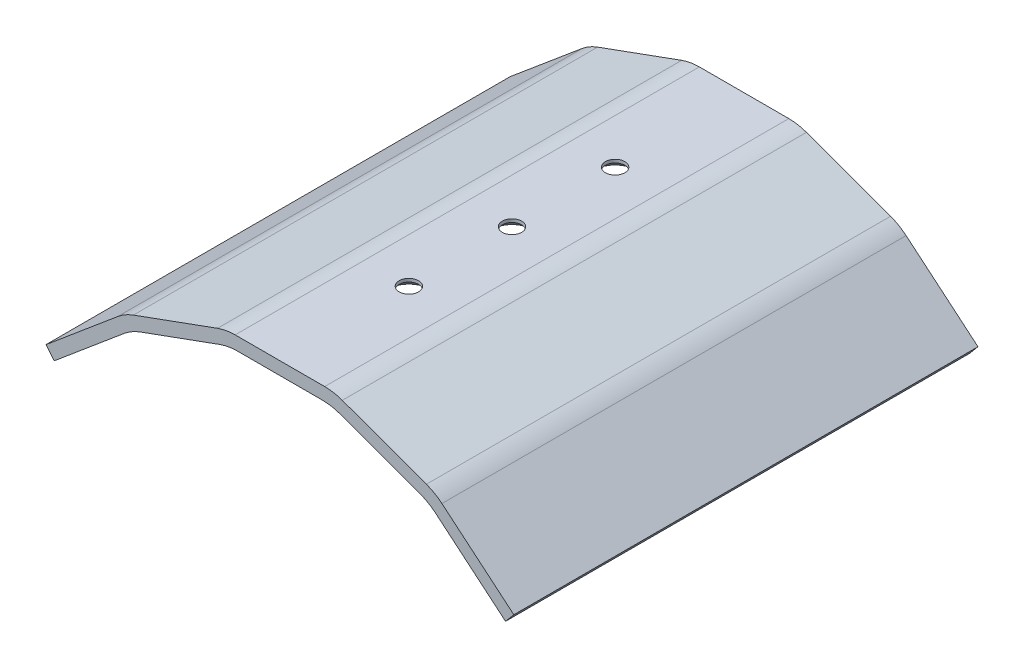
SolidWorks part; units mm, degrees
ref_plane "Front Plane" through (0, 0, 0) normal (0, 0, 1) x (1, 0, 0)
ref_plane "Top Plane" through (0, 0, 0) normal (0, 1, 0) x (1, 0, 0)
ref_plane "Right Plane" through (0, 0, 0) normal (1, 0, 0) x (0, 0, -1)
sketch "Sketch1" plane through (0, 0, 0) normal (0, 0, 1) x (1, 0, 0)
  line L0 (0, 0) -> (0, 14.4748) construction
  line L1 (0, 0) -> (12.7, 0)
  line L2 (12.7, 0) -> (36.5682, -8.6873)
  line L3 (36.5682, -8.6873) -> (55.5625, -24.6254)
  line L4 (55.5625, -24.6254) -> (57.6034, -22.1932)
  line L5 (57.6034, -22.1932) -> (38.1802, -5.8953)
  line L6 (38.1802, -5.8953) -> (13.2598, 3.175)
  line L7 (13.2598, 3.175) -> (-13.2598, 3.175)
  line L8 (-13.2598, 3.175) -> (-38.1802, -5.8953)
  line L9 (-38.1802, -5.8953) -> (-57.6034, -22.1932)
  line L10 (-57.6034, -22.1932) -> (-55.5625, -24.6254)
  line L11 (-55.5625, -24.6254) -> (-36.5682, -8.6873)
  line L12 (-36.5682, -8.6873) -> (-12.7, 0)
  line L13 (-12.7, 0) -> (0, 0)
  dimension "D1" = 3.175
  dimension "D2" = 3.175
  dimension "D3" = 3.175
  dimension "D4" = 111.125
  dimension "D5" = 160
  dimension "D6" = 160
  dimension "D7" = 25.4
  dimension "D8" = 25.4
  dimension "D9" = 25.3551
  dimension "D10" = 26.5197
  dimension "D11" = 26.5197
  dimension "D12" = 26.5197
  dimension "D13" = 25.3551
extrude "Boss-Extrude1" add sketch "Sketch1" along normal blind 114.3
fillet "Fillet1" radius 12.7 8 edges at (-36.5682, -8.6873, 57.15) (-12.7, 0, 57.15) (12.7, 0, 57.15) (36.5682, -8.6873, 57.15) (38.1802, -5.8953, 57.15) (13.2598, 3.175, 57.15) (-13.2598, 3.175, 57.15) (-38.1802, -5.8953, 57.15)
sketch "Sketch2" plane through (0, 0, 0) normal (0, 1, 0) x (1, 0, 0)
  line L0 (-11.0205, -57.15) -> (11.0205, -57.15) construction
  line L1 (-11.0205, 0) -> (-11.0205, -114.3) construction
  line L2 (11.0205, -114.3) -> (11.0205, 0) construction
  circle A0 centre (0, -31.75) radius 2.3876
  circle A1 centre (0, -57.15) radius 2.3876
  circle A2 centre (0, -82.55) radius 2.3876
  dimension "D1" = 4.7752
  dimension "D2" = 50.8
extrude "Cut-Extrude1" cut sketch "Sketch2" along normal blind 25.4
chamfer "Chamfer1" distance 2.3876 angle 49 3 edges at (0, 0, 34.1376) (0, 0, 59.5376) (0, 0, 84.9376)
